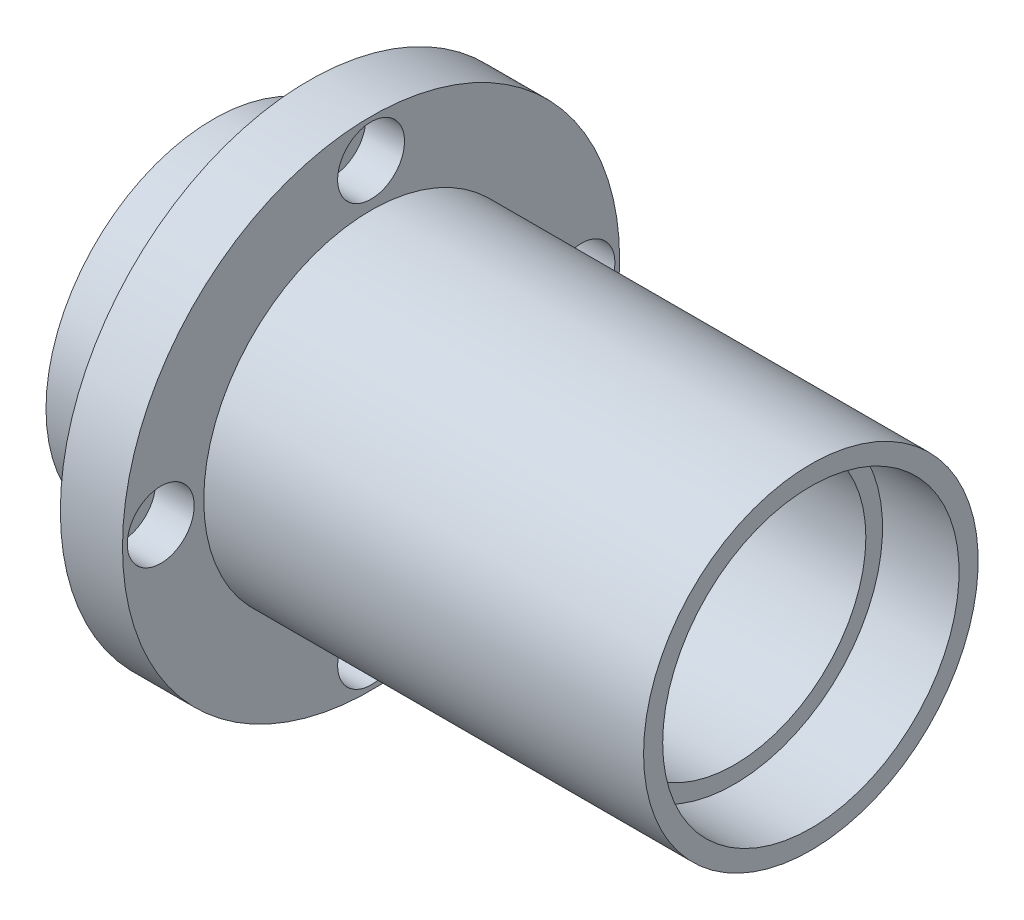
SolidWorks part; units mm, degrees
ref_plane "Front X-Y" through (0, 0, 0) normal (0, 0, 1) x (1, 0, 0)
ref_plane "Top X-Z" through (0, 0, 0) normal (0, 1, 0) x (1, 0, 0)
ref_plane "Right Y-Z" through (0, 0, 0) normal (1, 0, 0) x (0, 0, -1)
ref_plane "Plane1" through (0, 0, 0) normal (0, 0, 1) x (1, 0, 0)
sketch "Sketch1" plane through (0, 0, 0) normal (0, 0, 1) x (1, 0, 0)
  line L0 (0, 35) -> (0, 31)
  line L1 (0, 31) -> (16, 31)
  line L2 (16, 31) -> (16, 27.5)
  line L3 (16, 27.5) -> (109, 27.5)
  line L4 (109, 27.5) -> (109, 31)
  line L5 (109, 31) -> (125, 31)
  line L6 (125, 31) -> (125, 35)
  line L7 (125, 35) -> (33, 35)
  line L8 (33, 35) -> (33, 52)
  line L9 (33, 52) -> (20, 52)
  line L10 (20, 52) -> (20, 35)
  line L11 (20, 35) -> (0, 35)
  line L12 (125, 0) -> (0, 0) construction
revolve "Revolve1" add sketch "Sketch1" angle 360 about L12
ref_plane "Plane2" through (0, 0, 0) normal (0, 0, 1) x (1, 0, 0)
sketch "Sketch2" plane through (0, 0, 0) normal (0, 0, 1) x (1, 0, 0)
  line L0 (20, 44) -> (20, 48.5)
  line L1 (20, 48.5) -> (24.9, 48.5)
  line L2 (24.9, 48.5) -> (24.9, 51)
  line L3 (24.9, 51) -> (33, 51)
  line L4 (33, 51) -> (33, 44)
  line L5 (33, 44) -> (20, 44)
  line L6 (33, 44) -> (20, 44) construction
revolve "Cut-Revolve1" cut sketch "Sketch2" angle 360 about L6
ref_plane "Plane3" through (0, 0, 0) normal (0, 0, 1) x (1, 0, 0)
sketch "Sketch3" plane through (0, 0, 0) normal (0, 0, 1) x (1, 0, 0)
  line L0 (20, -44) -> (20, -39.5)
  line L1 (20, -39.5) -> (24.9, -39.5)
  line L2 (24.9, -39.5) -> (24.9, -37)
  line L3 (24.9, -37) -> (33, -37)
  line L4 (33, -37) -> (33, -44)
  line L5 (33, -44) -> (20, -44)
  line L6 (33, -44) -> (20, -44) construction
revolve "Cut-Revolve2" cut sketch "Sketch3" angle 360 about L6
ref_plane "Plane4" through (0, 0, 44) normal (0, 0, 1) x (1, 0, 0)
sketch "Sketch4" plane through (0, 0, 44) normal (0, 0, 1) x (1, 0, 0)
  line L0 (20, 0) -> (20, 4.5)
  line L1 (20, 4.5) -> (24.9, 4.5)
  line L2 (24.9, 4.5) -> (24.9, 7)
  line L3 (24.9, 7) -> (33, 7)
  line L4 (33, 7) -> (33, 0)
  line L5 (33, 0) -> (20, 0)
  line L6 (33, 0) -> (20, 0) construction
revolve "Cut-Revolve3" cut sketch "Sketch4" angle 360 about L6
ref_plane "Plane5" through (0, 0, -44) normal (0, 0, 1) x (1, 0, 0)
sketch "Sketch5" plane through (0, 0, -44) normal (0, 0, 1) x (1, 0, 0)
  line L0 (20, 0) -> (20, 4.5)
  line L1 (20, 4.5) -> (24.9, 4.5)
  line L2 (24.9, 4.5) -> (24.9, 7)
  line L3 (24.9, 7) -> (33, 7)
  line L4 (33, 7) -> (33, 0)
  line L5 (33, 0) -> (20, 0)
  line L6 (33, 0) -> (20, 0) construction
revolve "Cut-Revolve4" cut sketch "Sketch5" angle 360 about L6
sketch "Sketch6" plane through (33, 0, 0) normal (1, 0, 0) x (0, 0, -1)
  circle A0 centre (0, 44) radius 9 construction
  circle A2 centre (0, 0) radius 35 construction
  dimension "D1" = 18
sketch "Sketch7" plane through (20, 0, 0) normal (-1, 0, 0) x (0, 0, 1)
  line L0 (44, 0) -> (0, 0) construction
